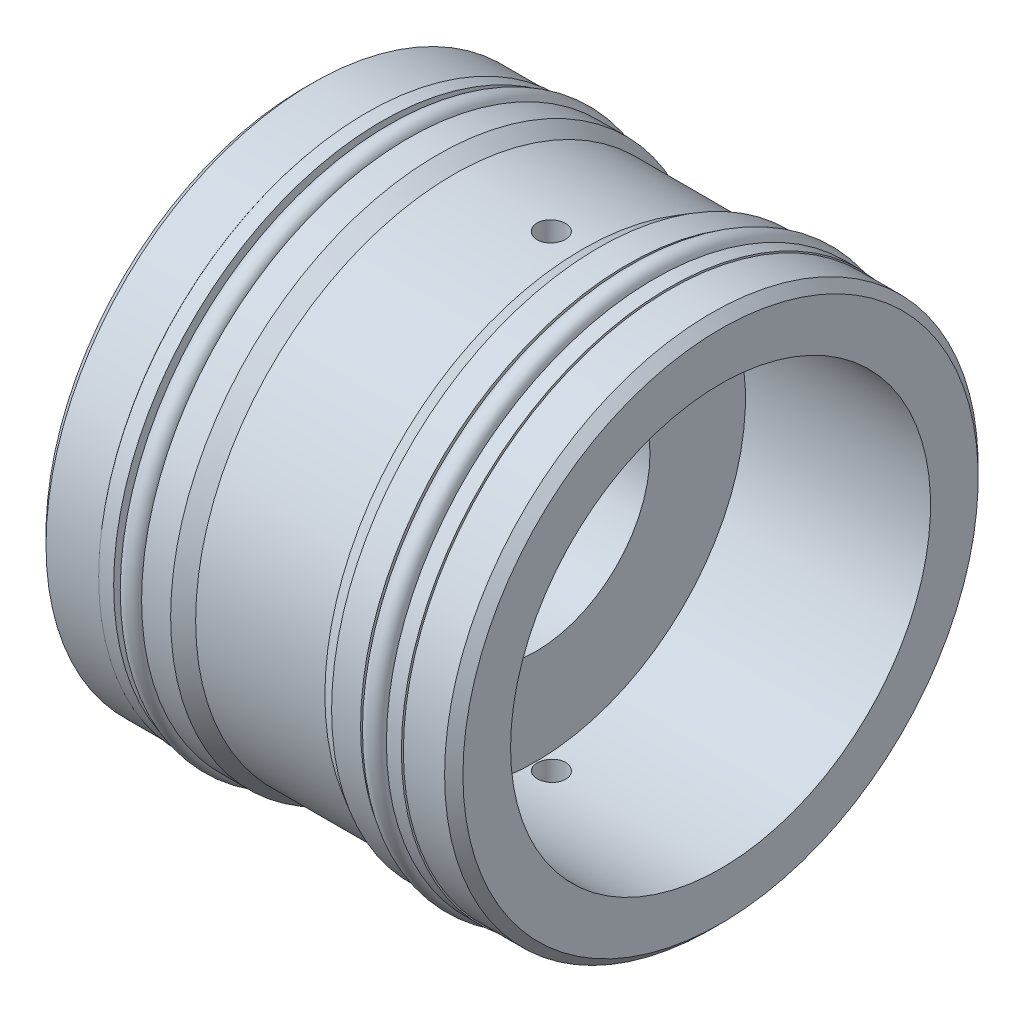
SolidWorks part; units mm, degrees
ref_plane "Front Plane" through (0, 0, 0) normal (0, 0, 1) x (1, 0, 0)
ref_plane "Top Plane" through (0, 0, 0) normal (0, 1, 0) x (1, 0, 0)
ref_plane "Right Plane" through (0, 0, 0) normal (1, 0, 0) x (0, 0, -1)
sketch "Sketch1" plane through (0, 0, 0) normal (0, 0, 1) x (1, 0, 0)
  line L0 (0, 0) -> (0, 45.5562) construction
  line L1 (0, 0) -> (32.8567, 0) construction
  line L2 (-17.3355, 9.525) -> (-17.3355, 22.1869)
  line L3 (-17.3355, 22.1869) -> (-12.1793, 22.1869)
  line L4 (-12.1793, 22.1869) -> (-12.1793, 20.9296)
  line L5 (-12.1793, 20.9296) -> (-8.6233, 20.9296)
  line L6 (-8.6233, 20.9296) -> (-8.6233, 22.1869)
  line L7 (-8.6233, 22.1869) -> (-6.2103, 22.1869)
  line L8 (-6.2103, 22.1869) -> (-6.2103, 21.4249)
  line L9 (-6.2103, 21.4249) -> (7.1755, 21.4249)
  line L10 (-17.3355, 9.525) -> (1.9431, 9.525)
  line L11 (1.9431, 9.525) -> (1.9431, 17.4625)
  line L12 (1.9431, 17.4625) -> (17.3355, 17.4625)
  line L13 (7.1755, 22.1869) -> (7.1755, 21.4249)
  line L14 (9.5885, 22.1869) -> (7.1755, 22.1869)
  line L15 (9.5885, 20.9296) -> (9.5885, 22.1869)
  line L16 (13.1445, 20.9296) -> (9.5885, 20.9296)
  line L17 (13.1445, 22.1869) -> (13.1445, 20.9296)
  line L18 (17.3355, 22.1869) -> (13.1445, 22.1869)
  line L19 (17.3355, 22.1869) -> (17.3355, 17.4625)
  dimension "D2" = 3.556
  dimension "D3" = 13.3858
  dimension "D4" = 44.3738
  dimension "D5" = 34.671
  dimension "D6" = 34.925
  dimension "D7" = 15.3924
  dimension "D8" = 42.8498
  dimension "D9" = 41.8592
  dimension "D10" = 19.05
  dimension "D11" = 29.5148
  dimension "D12" = 2.413
  dimension "D13" = 2.413
revolve "Revolve1" add sketch "Sketch1" angle 360 about L1
fillet "Fillet1" radius 0.381 2 edges at (7.1755, 0, 21.4249) (-6.2103, 0, 21.4249)
chamfer "Chamfer1" distance 0.762 angle 45 2 edges at (17.3355, 0, 22.1869) (-17.3355, 0, 22.1869)
sketch "Sketch6" plane through (0, 0, 0) normal (0, 0, 1) x (1, 0, 0)
  line L0 (0, 0) -> (49.5791, 0) construction
  line L1 (-17.3355, 21.4249) -> (-17.3355, -21.4249) construction
  line L2 (-8.6233, 20.9296) -> (-12.1793, 20.9296) construction
  line L3 (-12.1031, 20.9296) -> (-10.8585, 20.9296)
  line L4 (-12.1031, 20.9296) -> (-12.1031, 22.2758)
  line L5 (-12.1031, 22.2758) -> (-10.8585, 22.2758)
  line L6 (-10.8585, 20.9296) -> (-10.8585, 22.2758)
  line L7 (0.4826, 41.4439) -> (0.4826, -9.3524) construction
  line L8 (-12.1793, -22.1869) -> (-12.1793, 22.1869) construction
  line L9 (13.1445, 20.9296) -> (13.1445, -20.9296) construction
  line L10 (-8.6233, 22.1869) -> (-8.6233, -22.1869) construction
  line L11 (11.8237, 20.9296) -> (11.8237, 22.2758)
  line L12 (13.0683, 22.2758) -> (11.8237, 22.2758)
  line L13 (13.0683, 20.9296) -> (13.0683, 22.2758)
  line L14 (13.0683, 20.9296) -> (11.8237, 20.9296)
  circle A0 centre (-9.5885, 21.7424) radius 0.889
  circle A1 centre (10.5537, 21.7424) radius 0.889
  dimension "D4" = 1.778
  dimension "D5" = 43.4848
  dimension "D6" = 0.9652
  dimension "D1" = 1.2446
  dimension "D2" = 5.2324
  dimension "D3" = 44.5516
revolve "Revolve3" add sketch "Sketch6" angle 360 about L0
sketch "Sketch7" plane through (0, 0, 0) normal (0, 1, 0) x (0, 0, -1)
  line L1 (-21.4249, -17.3355) -> (21.4249, -17.3355) construction
  circle A0 centre (0, -3.2639) radius 1.1811
  dimension "D1" = 2.3622
  dimension "D2" = 14.0716
extrude "Cut-Extrude1" cut sketch "Sketch7" against normal through all and the other way through all
sketch "Sketch8" plane through (0, 0, 0) normal (0, 0, 1) x (1, 0, 0)
  line L0 (0, 0) -> (24.8718, 0) construction
  line L1 (7.1755, 22.1869) -> (5.8557, 21.4249)
  line L2 (6.7945, 21.4249) -> (4.445, 21.4249) construction
  line L3 (5.8557, 21.4249) -> (7.1755, 21.4249)
  line L4 (7.1755, 22.1869) -> (7.1755, -22.1869) construction
  line L5 (7.1755, 21.4249) -> (7.1755, 22.1869)
  line L6 (0.4826, 27.4365) -> (0.4826, -4.2062) construction
  line L7 (-6.2103, -22.1869) -> (-6.2103, 22.1869) construction
  line L8 (7.1755, 21.8059) -> (7.1755, -21.8059) construction
  line L9 (-6.2103, 21.4249) -> (-6.2103, 22.1869)
  line L10 (-4.8905, 21.4249) -> (-6.2103, 21.4249)
  line L11 (-6.2103, 22.1869) -> (-4.8905, 21.4249)
  dimension "D1" = 30
revolve "Revolve4" add sketch "Sketch8" angle 360 about L0
